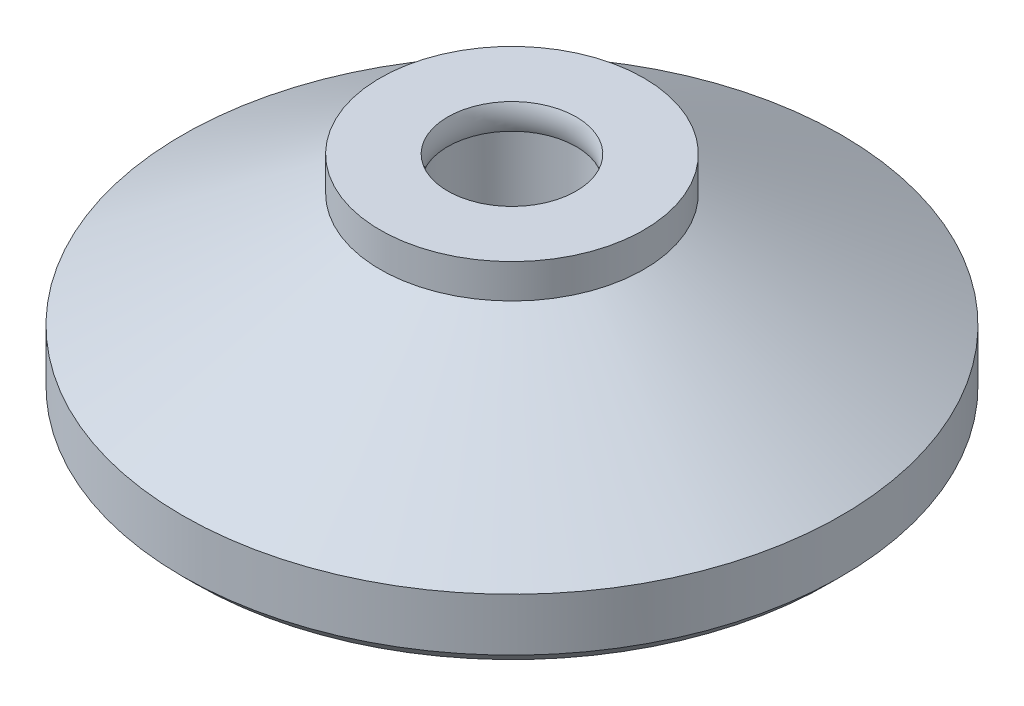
SolidWorks part; units mm, degrees
ref_plane "Front Plane" through (0, 0, 0) normal (0, 0, 1) x (1, 0, 0)
ref_plane "Top Plane" through (0, 0, 0) normal (0, 1, 0) x (1, 0, 0)
ref_plane "Right Plane" through (0, 0, 0) normal (1, 0, 0) x (0, 0, -1)
sketch "Sketch1" plane through (0, 0, 0) normal (0, 1, 0) x (1, 0, 0)
  circle A0 centre (0, 0) radius 8
  dimension "D1" = 16
extrude "Extrude1" add sketch "Sketch1" along normal mid plane 13
sketch "Sketch3" plane through (0, -6.5, 0) normal (0, -1, 0) x (1, 0, 0)
  circle A0 centre (0, 0) radius 20
  dimension "D1" = 40
extrude "Extrude2" add sketch "Sketch3" against normal blind 4
sketch "Sketch4" plane through (0, 0, 0) normal (0, 0, 1) x (1, 0, 0)
  line L0 (-20, -2.5) -> (-8, 4.4282)
  line L1 (-8, 6.5) -> (-8, -2.5) construction
  line L2 (-8, 4.4282) -> (-8, -2.5)
  line L3 (-8, -2.5) -> (-20, -2.5)
  dimension "D1" = 30
revolve "Revolve1" add sketch "Sketch4" angle 360 about axis through (0, 6.5, 0) along (0, -1, 0)
chamfer "Chamfer1" distance 0.8 angle 45 1 edges at (0, -6.5, -20)
sketch "Sketch5" plane through (0, 0, 0) normal (0, 0, 1) x (1, 0, 0)
  line L1 (0, 0) -> (0, 11.3083) construction
  line L2 (0, 6.5) -> (3.9, 6.5)
  line L3 (8, 6.5) -> (-8, 6.5) construction
  line L4 (3.9, 4.94) -> (3.9, -0.2483)
  line L5 (3.9, -0.2483) -> (0, -2.5)
  line L6 (0, -2.5) -> (0, 6.5)
  line L7 (20, -2.5) -> (-20, -2.5) construction
  arc A0 (3.9, 6.5) -> (3.9, 4.94) centre (5.772, 5.72) ccw
  point P14 (3.744, 5.72)
  dimension "D2" = 7.8
  dimension "D1" = 60
  dimension "D3" = 1.56
  dimension "D4" = 0.156
revolve "Cut-Revolve1" cut sketch "Sketch5" angle 360 about L1
equation "\"D3@Sketch5\" = \"D2@Sketch5\"*0.2"
equation "\"D4@Sketch5\" = \"D3@Sketch5\"*0.1"
